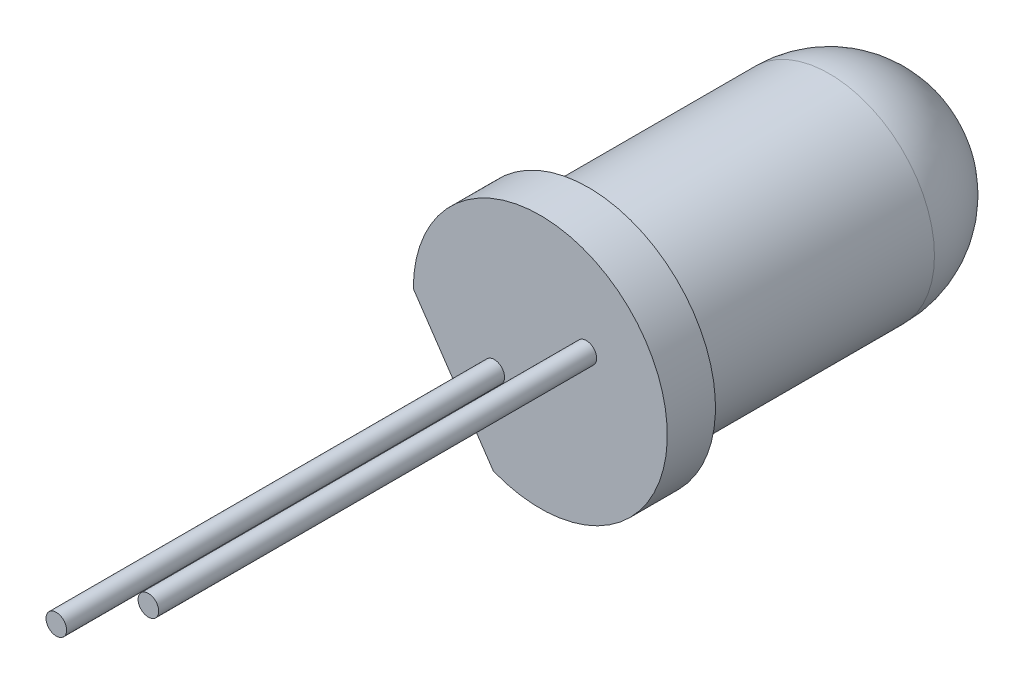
SolidWorks part; units mm, degrees
ref_plane "Plan de face" through (0, 0, 0) normal (0, 0, 1) x (1, 0, 0)
ref_plane "Plan de dessus" through (0, 0, 0) normal (0, 1, 0) x (1, 0, 0)
ref_plane "Plan de droite" through (0, 0, 0) normal (1, 0, 0) x (0, 0, -1)
mirrored part "del5_Rendre symétrique"
other "<del5>-<Boss.-Extru.2>"
